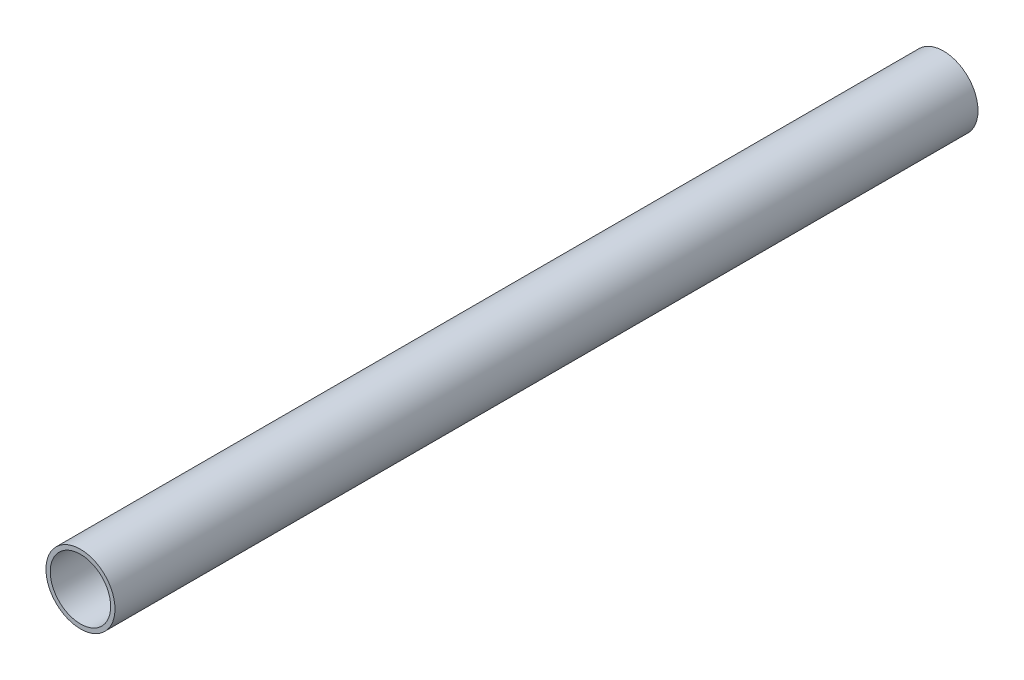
SolidWorks part; units mm, degrees
ref_plane "前视基准面" through (0, 0, 0) normal (0, 0, 1) x (1, 0, 0)
ref_plane "上视基准面" through (0, 0, 0) normal (0, 1, 0) x (1, 0, 0)
ref_plane "右视基准面" through (0, 0, 0) normal (1, 0, 0) x (0, 0, -1)
other "Configuration Table"
sketch "草图1" plane through (0, 0, 0) normal (0, 0, 1) x (1, 0, 0)
  circle A0 centre (0, 0) radius 8
  circle A1 centre (0, 0) radius 7
extrude "凸台-拉伸1" add sketch "草图1" along normal blind 200
